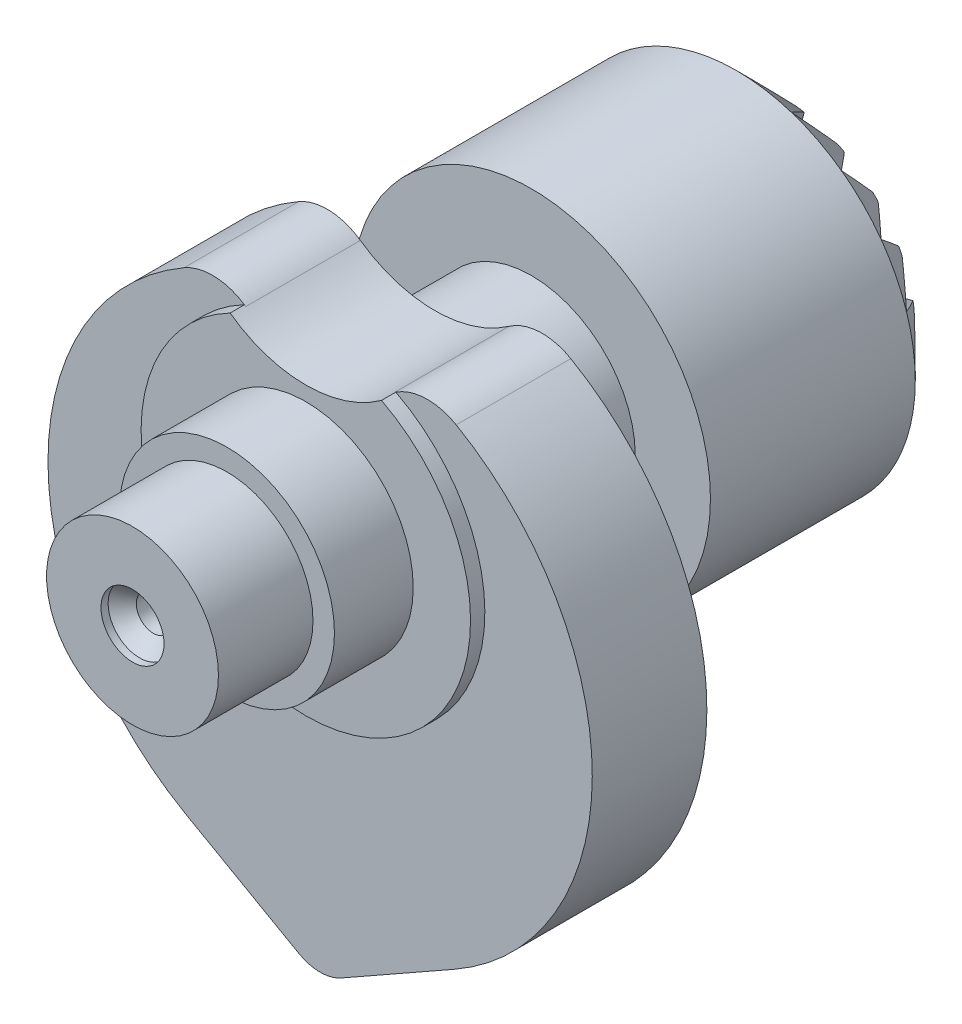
SolidWorks part; units mm, degrees
ref_plane "Plan1" through (0, 0, 0) normal (0, 0, 1) x (1, 0, 0)
ref_plane "Plan2" through (0, 0, 0) normal (0, 1, 0) x (1, 0, 0)
ref_plane "Plan3" through (0, 0, 0) normal (1, 0, 0) x (0, 0, -1)
sketch "Esquisse1" plane through (0, 0, 0) normal (0, 0, 1) x (1, 0, 0)
  line L0 (0, 68) -> (0, -43) construction
  line L1 (0, 45.0054) -> (0, -4.0048) construction
  line L2 (-9.3687, 4.8616) -> (-1.4793, 0.3901)
  line L3 (9.3687, 4.8616) -> (1.4793, 0.3901)
  arc A0 (-9.5, 37.8457) -> (-9.3687, 4.8616) centre (0, 21.3912) ccw
  arc A1 (-1.4793, 0.3901) -> (1.4793, 0.3901) centre (0, 3) ccw
  arc A2 (-5.1923, 37.6488) -> (-9.5, 37.8457) centre (-7.5, 34.3816) ccw
  arc A3 (5.1923, 37.6488) -> (9.5, 37.8457) centre (7.5, 34.3816) cw
  arc A4 (-5.1923, 37.6488) -> (5.1923, 37.6488) centre (0, 45) ccw
  arc A5 (9.3687, 4.8616) -> (9.5, 37.8457) centre (0, 21.3912) ccw
  point P49 (0, 36)
  point P51 (0, 0)
  dimension "D1" = 9
  dimension "D19" = 7.5
  dimension "D18" = 8
  dimension "D2" = 19
  dimension "D3" = 3
  dimension "D4" = 38.3816
  dimension "D20" = 36
extrude "Base-Extrusion" add sketch "Esquisse1" along normal blind 8
sketch "Esquisse2" plane through (0, 0, 8) normal (0, 0, 1) x (1, 0, 0)
  line L0 (0, 74) -> (0, -7) construction
  line L1 (-38, 27.5) -> (35, 27.5) construction
  arc A0 (-5.2838, 37.7143) -> (5.2838, 37.7143) centre (0, 27.5) ccw
  arc A1 (-5.1923, 37.6488) -> (5.1923, 37.6488) centre (0, 45) ccw construction
  arc A2 (-5.2838, 37.7143) -> (5.2838, 37.7143) centre (0, 45) ccw
  point P5 (0, 36)
  dimension "D2" = 8.5
  dimension "D1" = 23
extrude "Boss.-Extru.1" add sketch "Esquisse2" along normal blind 1
sketch "Esquisse3" plane through (0, 0, 9) normal (0, 0, 1) x (1, 0, 0)
  circle A0 centre (0, 27.5) radius 7.5
  arc A1 (-5.2838, 37.7143) -> (5.2838, 37.7143) centre (0, 27.5) ccw construction
  dimension "D1" = 15
extrude "Boss.-Extru.2" add sketch "Esquisse3" along normal blind 5.5
sketch "Esquisse4" plane through (0, 0, 14.5) normal (0, 0, 1) x (1, 0, 0)
  circle A0 centre (0, 27.5) radius 6
  circle A1 centre (0, 27.5) radius 7.5 construction
  dimension "D1" = 12
extrude "Boss.-Extru.3" add sketch "Esquisse4" along normal blind 6.6
sketch "Esquisse5" plane through (0, 0, 0) normal (0, 0, -1) x (-1, 0, 0)
  line L0 (0, 75) -> (0, -7) construction
  line L1 (-40, 27.5) -> (45, 27.5) construction
  circle A0 centre (0, 27.5) radius 7.25
  arc A1 (-5.2838, 37.7143) -> (5.2838, 37.7143) centre (0, 45) ccw construction
  dimension "D2" = 14.5
  dimension "D1" = 8.5
extrude "Boss.-Extru.4" add sketch "Esquisse5" along normal blind 6.75
sketch "Esquisse6" plane through (0, 0, -6.75) normal (0, 0, -1) x (-1, 0, 0)
  line L1 (0, 68) -> (0, -43) construction
  circle A0 centre (0, 27.5) radius 12.5
  circle A1 centre (0, 27.5) radius 7.25 construction
  dimension "D1" = 25
extrude "Boss.-Extru.5" add sketch "Esquisse6" along normal blind 17.3
sketch "Esquisse8" plane through (0, 0, -24.05) normal (0, 0, -1) x (-1, 0, 0)
  line L0 (-12.5, 79) -> (-12.5, 47) construction
  circle A0 centre (0, 27.5) radius 12.5 construction
ref_plane "Plan5" through (9.4052, 0, 1.1548) normal (0.9925, 0, 0.1219) x (0.1219, 0, -0.9925)
sketch "Esquisse13" plane through (0, 0, -24.05) normal (0, 0, -1) x (-1, 0, 0)
  circle A0 centre (0, 27.5) radius 4.5
  circle A1 centre (0, 27.5) radius 6 construction
  dimension "D1" = 9
extrude "Enlèv. mat.-Extru.2" cut sketch "Esquisse13" against normal blind 6
hole_wizard "Perçage2" positions "Esquisse15" profile "Esquisse14" tap size "M8x1.25" standard "ISO"
sketch "Esquisse15" plane through (0, 0, -18.05) normal (0, 0, -1) x (-1, 0, 0)
  circle A0 centre (0, 27.5) radius 4.5 construction
  point P0 (0, 27.5)
sketch "Esquisse14" plane through (0, 27.5, -18.05) normal (1, 0, 0) x (0, 1, 0)
  line L0 (0, 0) -> (0, 24.2929)
  line L1 (0, 24.2929) -> (3.4, 22.25)
  line L2 (3.4, 22.25) -> (3.4, 16)
  line L3 (3.4, 16) -> (4, 16)
  line L4 (4, 16) -> (4, 0)
  line L5 (4, 0) -> (0, 0)
  line L10 (0, 24.2929) -> (-3.4, 22.25) construction
  line L11 (0, -6.35) -> (0, 107.95) construction
  dimension "Diamètre du trou pour taraudage" = 6.8
  dimension "Profondeur du trou pour taraudage" = 22.25
  dimension "Diamètre du filetage" = 8
  dimension "Profondeur du filetage" = 16
  dimension "Angle de pointe" = 118
sketch "Esquisse9" plane through (9.4052, 0, 1.1548) normal (0.9925, 0, 0.1219) x (0.1219, 0, -0.9925)
  line L0 (9.1236, 27.5) -> (37.7724, 27.5) construction
  line L1 (6.6997, 27.5) -> (0, 27.5) construction
  line L2 (27.3941, 29.8315) -> (27.3941, 25.1685)
  line L3 (27.3941, 29.8315) -> (22.3941, 27.5)
  line L4 (27.3941, 25.1685) -> (22.3941, 27.5)
  line L5 (25.3941, 76) -> (25.3941, 52) construction
  ellipse E2 centre (23.8707, 27.5) end of major axis (23.8707, 15) minor radius 1.5234 construction
  point P7 (27.3941, 27.5)
  dimension "D1" = 50
  dimension "D2" = 3
  dimension "D3" = 5
extrude "Enlèv. mat.-Extru.1" cut sketch "Esquisse9" against normal blind 12.5 and the other way through all
chamfer "Chanfrein1" distance 3 angle 45
pattern_circular "Répétition circulaire1" count 20 over 360
hole_wizard "Perçage1" positions "Esquisse11" profile "Esquisse10" countersink size "M2" standard "ISO"
sketch "Esquisse11" plane through (0, 0, 21.1) normal (0, 0, 1) x (1, 0, 0)
  circle A0 centre (0, 27.5) radius 6 construction
  point P0 (0, 27.5)
sketch "Esquisse10" plane through (0, 27.5, 21.1) normal (1, 0, 0) x (0, -1, 0)
  line L0 (0, 0) -> (0, 5.721)
  line L1 (0, 5.721) -> (1.2, 5)
  line L2 (1.2, 5) -> (1.2, 1.4657)
  line L3 (1.2, 1.4657) -> (2.2, 0.5)
  line L4 (2.2, 0.5) -> (2.2, 0)
  line L6 (2.2, 0) -> (0, 0)
  line L7 (-1.2, 1.4657) -> (-2.2, 0.5) construction
  line L10 (0, 5.721) -> (-1.2, 5) construction
  line L11 (0, -6.35) -> (0, 107.95) construction
  dimension "Diamètre du perçage" = 2.4
  dimension "Profondeur du perçage" = 5
  dimension "Diamètre du fraisage" = 4.4
  dimension "Angle du fraisage" = 92
  dimension "Angle de pointe" = 118
  dimension "Dégagement de la tête" = 0.5
ref_plane "Plan6" through (4.249, 0.673, 0) normal (0.9877, 0.1564, 0) x (0, 0, -1)
